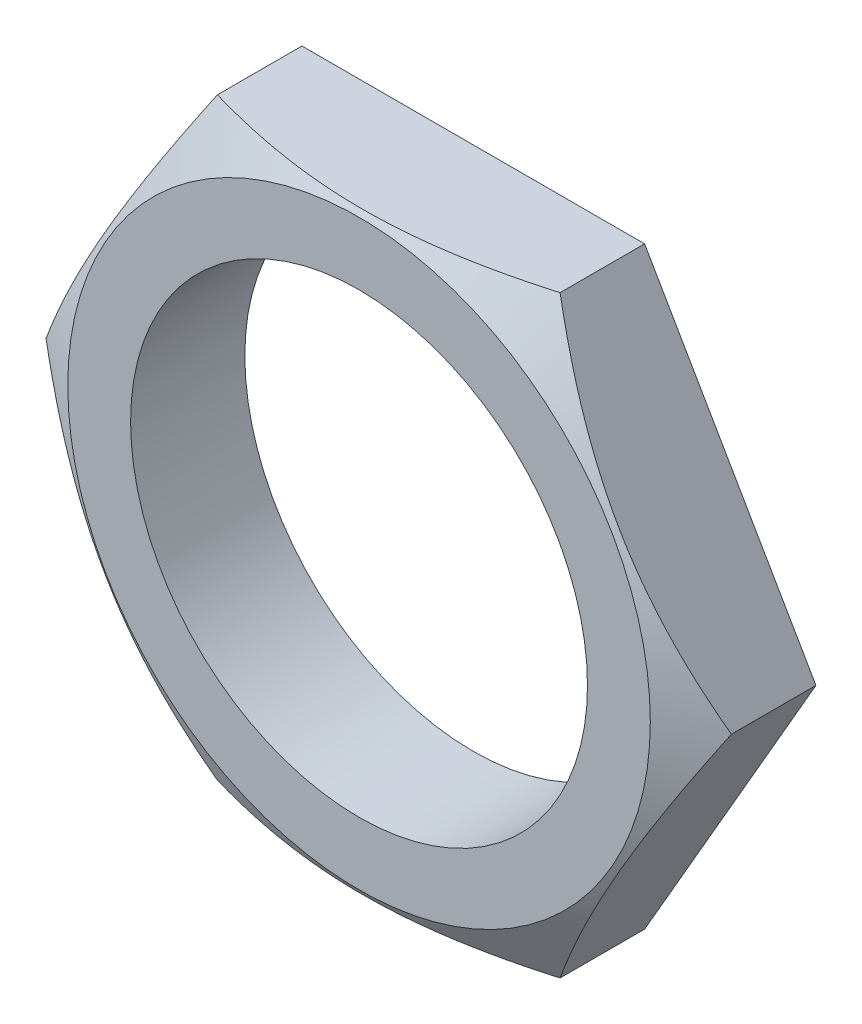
SolidWorks part; units mm, degrees
ref_plane "frontal" through (0, 0, 0) normal (0, 0, 1) x (1, 0, 0)
ref_plane "horizontal" through (0, 0, 0) normal (0, 1, 0) x (1, 0, 0)
ref_plane "profil" through (0, 0, 0) normal (1, 0, 0) x (0, 0, -1)
sketch "Esquisse1" plane through (0, 0, 0) normal (0, 0, 1) x (1, 0, 0)
  circle A0 centre (0, 0) radius 4
  circle A1 centre (0, 0) radius 6
  dimension "D1" = 8
  dimension "D2" = 12
extrude "Base-Extrusion" add sketch "Esquisse1" along normal blind 2
chamfer "Chanfrein1" distance 0.9 angle 30 1 edges at (6, 0, 2)
sketch "Esquisse2" plane through (0, 0, 0) normal (0, 0, -1) x (-1, 0, 0)
  line L0 (6, 0) -> (3, 5.1962)
  line L1 (0, 0) -> (2, 0) construction
  circle A0 centre (0, 0) radius 6 construction
  arc A1 (6, 0) -> (3, 5.1962) centre (0, 0) ccw
  dimension "D1" = 60
extrude "Enlèv. mat.-Extru.1" cut sketch "Esquisse2" against normal through all
pattern_circular "Répétition circulaire1" count 6 every 60 about axis through (0, 0, 0) along (0, 0, 1) of "Enlèv. mat.-Extru.1"
